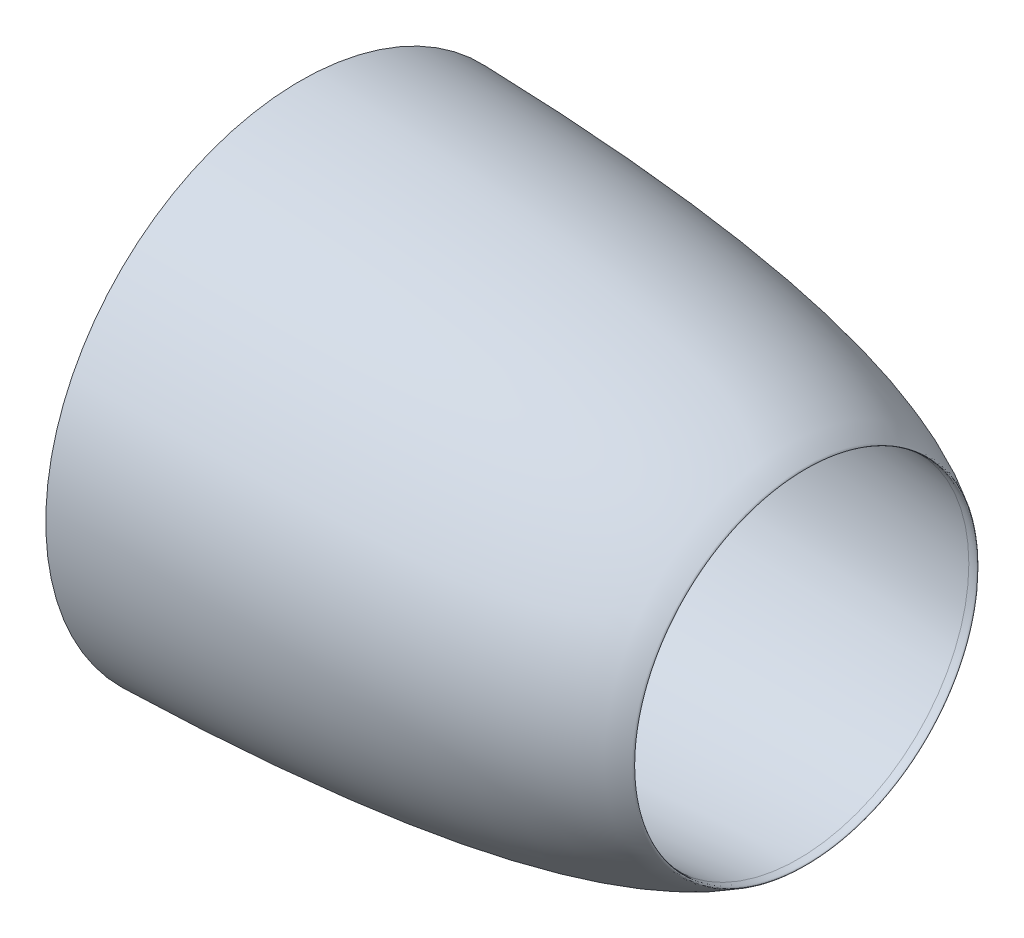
SolidWorks part; units mm, degrees
ref_plane "Plan de face" through (0, 0, 0) normal (0, 0, 1) x (1, 0, 0)
ref_plane "Plan de dessus" through (0, 0, 0) normal (0, 1, 0) x (1, 0, 0)
ref_plane "Plan de droite" through (0, 0, 0) normal (1, 0, 0) x (0, 0, -1)
ref_axis "Axe1" through (113.0067, 0, 0) along (-1, 0, 0)
sketch "Esquisse1" plane through (0, 0, 0) normal (0, 0, 1) x (1, 0, 0)
  line L1 (0, 40) -> (80, 33.0009)
  line L4 (122.4545, 0) -> (-69.95, 0) construction
  arc A0 (0, 40) -> (-16.2695, 49.2274) centre (1.961, 62.4144) cw
  spline S0 degree 2 poles (-16.2695, 49.2274) (57.7, 47.5161) (82.4369, 32.8054) (80, 33.0009) knots 0 0 0 0.940489 1 1 1
  dimension "D1" = 40
  dimension "D2" = 5
  dimension "D3" = 80
  dimension "D4" = 22.5
revolve "Révolution1" add sketch "Esquisse1" angle 360 about axis through (113.0067, 0, 0) along (-1, 0, 0)
